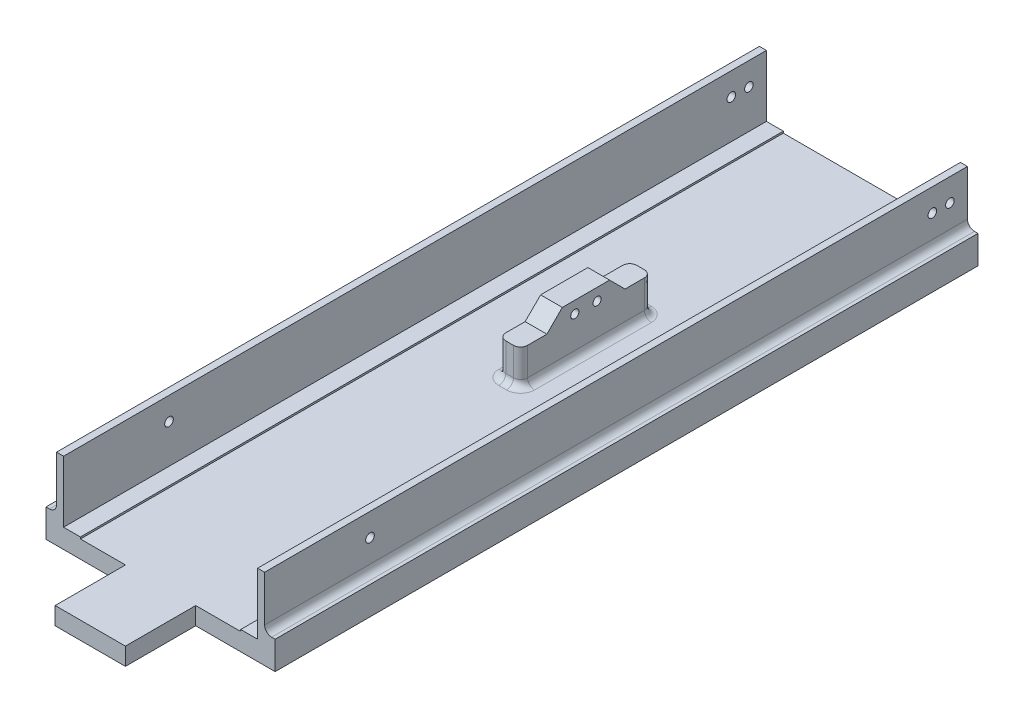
SolidWorks part; units mm, degrees
ref_plane "Front Plane" through (0, 0, 0) normal (0, 0, 1) x (1, 0, 0)
ref_plane "Top Plane" through (0, 0, 0) normal (0, 1, 0) x (1, 0, 0)
ref_plane "Right Plane" through (0, 0, 0) normal (1, 0, 0) x (0, 0, -1)
sketch "Sketch1" plane through (0, 0, 0) normal (0, 0, 1) x (1, 0, 0)
  line L0 (0, 0) -> (0, 25)
  line L1 (0, 25) -> (5, 25)
  line L2 (5, 25) -> (5, 5)
  line L3 (5, 5) -> (60.2, 5)
  line L4 (60.2, 5) -> (60.2, 25)
  line L5 (60.2, 25) -> (65.2, 25)
  line L6 (65.2, 25) -> (65.2, 0)
  line L7 (65.2, 0) -> (0, 0)
  dimension "D1" = 5
  dimension "D2" = 5
  dimension "D3" = 55.2
  dimension "D4" = 5
  dimension "D5" = 20
  dimension "D6" = 20
extrude "Boss-Extrude1" add sketch "Sketch1" along normal blind 400
sketch "Sketch2" plane through (0, 5, 0) normal (0, 1, 0) x (1, 0, 0)
  line L1 (29.51, -63.42) -> (35.69, -63.42)
  line L2 (29.51, -63.42) -> (29.51, -100.67)
  line L3 (29.51, -100.67) -> (35.69, -100.67)
  line L4 (35.69, -63.42) -> (35.69, -100.67)
  line L7 (60.2, -400) -> (5, -400) construction
  line L10 (0, -400) -> (0, 0) construction
  circle A0 centre (32.6, -67.17) radius 2.1
  circle A1 centre (32.6, -96.92) radius 2.1
  circle A2 centre (32.6, -67.17) radius 2.1
  circle A3 centre (32.6, -96.92) radius 2.1
  dimension "D5" = 4.2
  dimension "D1" = 6.18
  dimension "D2" = 37.25
  dimension "D3" = 299.33
  dimension "D4" = 29.51
  dimension "D6" = 3.75
  dimension "D7" = 33.5
  dimension "D8" = 3.09
  dimension "D9" = 3.09
extrude "Cut-Extrude3" cut sketch "Sketch2" against normal blind 10 contours A0 | A1
sketch "Sketch3" plane through (0, 25, 0) normal (0, 1, 0) x (1, 0, 0)
  line L1 (-34.8959, 47.3477) -> (123.1433, 47.3477)
  line L2 (-34.8959, 47.3477) -> (-34.8959, -450.6402)
  line L3 (-34.8959, -450.6402) -> (123.1433, -450.6402)
  line L4 (123.1433, 47.3477) -> (123.1433, -450.6402)
extrude "Cut-Extrude4" cut sketch "Sketch3" against normal blind 2
sketch "Sketch4" plane through (0, 5, 0) normal (0, 1, 0) x (1, 0, 0)
  line L0 (60.2, -400) -> (5, -400) construction
  line L1 (5, 0) -> (9.8, 0)
  line L2 (5, 0) -> (5, -400)
  line L3 (5, -400) -> (9.8, -400)
  line L4 (9.8, 0) -> (9.8, -400)
  line L5 (60.2, 0) -> (5, 0) construction
  line L6 (55.4, 0) -> (60.2, 0)
  line L7 (55.4, 0) -> (55.4, -400)
  line L8 (55.4, -400) -> (60.2, -400)
  line L9 (60.2, 0) -> (60.2, -400)
  dimension "D1" = 4.8
  dimension "D2" = 4.8
extrude "Boss-Extrude2" add sketch "Sketch4" along normal blind 8
sketch "Sketch5" plane through (5, 0, 0) normal (1, 0, 0) x (0, 0, -1)
  line L0 (-400, 13) -> (-400, 23) construction
  line L1 (0, 13) -> (-400, 13) construction
  line L2 (-200, 13) -> (-200, 23)
  line L3 (-400, 23) -> (0, 23) construction
  line L4 (-400, 0) -> (-400, 23) construction
  circle A0 centre (-395, 16.5) radius 1.2
  circle A1 centre (-390, 16.5) radius 1.2
  circle A2 centre (-5, 16.5) radius 1.2
  circle A3 centre (-10, 16.5) radius 1.2
  dimension "D1" = 2.4
  dimension "D2" = 2.4
  dimension "D3" = 5
  dimension "D4" = 10
  dimension "D5" = 3.5
  dimension "D6" = 3.5
  dimension "D7" = 200
extrude "Cut-Extrude9" cut sketch "Sketch5" against normal through all contours A0 | A1 | A3 | A2
sketch "Sketch9" plane through (0, 0, 0) normal (-1, 0, 0) x (0, 0, 1)
  circle A0 centre (5, 16.5) radius 1.225
  circle A1 centre (10, 16.5) radius 1.225
  circle A2 centre (390, 16.5) radius 1.225
  circle A3 centre (395, 16.5) radius 1.225
  dimension "D1" = 2.45
extrude "Cut-Extrude10" cut sketch "Sketch9" against normal through all
sketch "Sketch10" plane through (0, 13, 0) normal (0, 1, 0) x (1, 0, 0)
  line L1 (5, 0) -> (9.8, 0)
  line L2 (5, 0) -> (5, -400)
  line L3 (5, -400) -> (9.8, -400)
  line L4 (9.8, 0) -> (9.8, -400)
  line L5 (55.4, -400) -> (60.2, -400)
  line L6 (55.4, -400) -> (55.4, 0)
  line L7 (55.4, 0) -> (60.2, 0)
  line L8 (60.2, -400) -> (60.2, 0)
extrude "Cut-Extrude11" cut sketch "Sketch10" against normal blind 5
sketch "Sketch12" plane through (0, 0, 0) normal (0, -1, 0) x (1, 0, 0)
  circle A0 centre (32.6, 96.92) radius 2.1
  circle A1 centre (32.6, 67.17) radius 2.1
extrude "Boss-Extrude3" add sketch "Sketch12" against normal blind 15
sketch "Sketch13" plane through (0, 5, 0) normal (0, 1, 0) x (1, 0, 0)
  line L1 (29.51, -63.42) -> (35.69, -63.42)
  line L2 (29.51, -63.42) -> (29.51, -100.67)
  line L3 (29.51, -100.67) -> (35.69, -100.67)
  line L4 (35.69, -63.42) -> (35.69, -100.67)
  circle A0 centre (32.6, -67.17) radius 2.1 construction
  circle A1 centre (32.6, -67.17) radius 2.1 construction
  dimension "D2" = 3.75
  dimension "D1" = 3.09
  dimension "D3" = 37.25
  dimension "D4" = 6.18
extrude "Boss-Extrude5" add sketch "Sketch13" along normal blind 10
sketch "Sketch14" plane through (29.51, 0, 0) normal (-1, 0, 0) x (0, 0, 1)
  line L0 (70.92, 15) -> (75.32, 19.4)
  line L1 (63.42, 15) -> (100.67, 15) construction
  line L2 (75.32, 19.4) -> (88.77, 19.4)
  line L3 (88.77, 19.4) -> (93.17, 15)
  line L4 (63.42, 15) -> (63.42, 5) construction
  line L5 (70.92, 15) -> (93.17, 15)
  dimension "D1" = 13.45
  dimension "D2" = 4.4
  dimension "D3" = 4.4
  dimension "D4" = 4.4
  dimension "D5" = 7.5
extrude "Boss-Extrude6" add sketch "Sketch14" against normal up to surface (6.18 mm away)
sketch "Sketch15" plane through (29.51, 0, 0) normal (-1, 0, 0) x (0, 0, 1)
  line L0 (100.67, 15) -> (100.67, 5) construction
  line L1 (63.42, 15) -> (63.42, 5) construction
  line L2 (88.77, 19.4) -> (75.32, 19.4) construction
  circle A0 centre (78.87, 16) radius 1.05
  circle A1 centre (85.22, 16) radius 1.05
  dimension "D4" = 3.4
  dimension "D5" = 2.1
  dimension "D6" = 2.1
  dimension "D1" = 15.45
  dimension "D2" = 15.45
  dimension "D3" = 3.4
extrude "Cut-Extrude12" cut sketch "Sketch15" against normal blind 10
fillet "Fillet1" radius 2 8 edges at (29.51, 10, 100.67) (35.69, 10, 100.67) (35.69, 10, 63.42) (29.51, 10, 63.42) (32.6, 5, 100.67) (35.69, 5, 82.045) (32.6, 5, 63.42) (29.51, 5, 82.045)
sketch "Sketch16" plane through (0, 8, 0) normal (0, 1, 0) x (1, 0, 0)
  line L1 (5, 0) -> (9.8, 0)
  line L2 (5, 0) -> (5, -400)
  line L3 (5, -400) -> (9.8, -400)
  line L4 (9.8, 0) -> (9.8, -400)
  line L5 (55.4, -400) -> (60.2, -400)
  line L6 (55.4, -400) -> (55.4, 0)
  line L7 (55.4, 0) -> (60.2, 0)
  line L8 (60.2, -400) -> (60.2, 0)
extrude "Cut-Extrude13" cut sketch "Sketch16" against normal blind 2.5
sketch "Sketch17" plane through (29.51, 0, 0) normal (-1, 0, 0) x (0, 0, 1)
  circle A0 centre (78.87, 16) radius 1.16
  circle A1 centre (85.22, 16) radius 1.16
  dimension "D1" = 2.32
  dimension "D2" = 2.32
extrude "Cut-Extrude14" cut sketch "Sketch17" against normal up to next
sketch "Sketch18" plane through (60.2, 0, 0) normal (-1, 0, 0) x (0, 0, 1)
  line L0 (5, 16.5) -> (170, 16.5)
  circle A0 centre (170, 16.5) radius 1.225
  circle A1 centre (5, 16.5) radius 1.225 construction
  dimension "D1" = 165
extrude "Cut-Extrude16" cut sketch "Sketch18" against normal through all and the other way through all
sketch "Sketch20" plane through (60.2, 0, 0) normal (-1, 0, 0) x (0, 0, 1)
  line L0 (395, 16.5) -> (230, 16.5)
  circle A0 centre (230, 16.5) radius 1.225
  circle A1 centre (395, 16.5) radius 1.225 construction
  dimension "D1" = 165
extrude "Cut-Extrude17" cut sketch "Sketch20" against normal through all and the other way through all
sketch "Sketch22" plane through (0, 0, 0) normal (0, 0, -1) x (-1, 0, 0)
  line L1 (-65.2, 23) -> (-62.2, 23)
  line L2 (-65.2, 23) -> (-65.2, 8)
  line L3 (-65.2, 8) -> (-62.2, 8)
  line L4 (-62.2, 23) -> (-62.2, 8)
  line L5 (0, 23) -> (-3, 23)
  line L6 (0, 23) -> (0, 8)
  line L7 (0, 8) -> (-3, 8)
  line L8 (-3, 23) -> (-3, 8)
  dimension "D1" = 15
  dimension "D2" = 3
  dimension "D3" = 3
  dimension "D4" = 15
extrude "Cut-Extrude18" cut sketch "Sketch22" against normal through all
fillet "Fillet2" radius 2 1 edges at (62.2, 8, 200)
fillet "Fillet3" radius 2 1 edges at (3, 8, 200)
sketch "Sketch24" plane through (0, 23, 0) normal (0, 1, 0) x (1, 0, 0)
  line L0 (0, -200) -> (65.2, -200)
  line L1 (0, 0) -> (65.2, 0)
  line L2 (0, 0) -> (0, -400)
  line L3 (0, -400) -> (65.2, -400)
  line L4 (65.2, 0) -> (65.2, -400)
  line L6 (22.6, -200) -> (42.6, -200)
  line L7 (22.6, -200) -> (22.6, -220)
  line L8 (22.6, -220) -> (42.6, -220)
  line L9 (42.6, -200) -> (42.6, -220)
  dimension "D1" = 20
  dimension "D2" = 22.6
  dimension "D3" = 20
extrude "Cut-Extrude20" cut sketch "Sketch24" against normal through all contours L0 L9 L8 L7 L2 L3 M5 | L4 L0 L3 M3 | L0 M5 M6 M3
